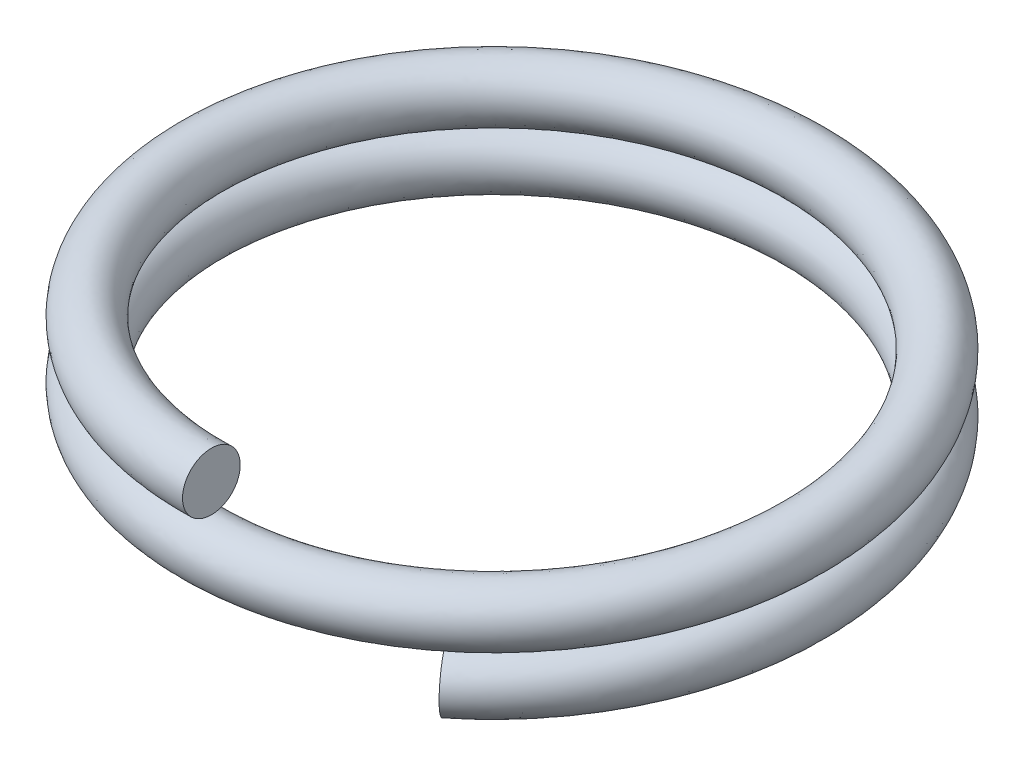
SolidWorks part; units mm, degrees
ref_plane "Front Plane" through (0, 0, 0) normal (0, 0, 1) x (1, 0, 0)
ref_plane "Top Plane" through (0, 0, 0) normal (0, 1, 0) x (1, 0, 0)
ref_plane "Right Plane" through (0, 0, 0) normal (1, 0, 0) x (0, 0, -1)
sketch "Sketch1" plane through (0, 0, 0) normal (0, 1, 0) x (1, 0, 0)
  circle A0 centre (0, 0) radius 14.5415
  dimension "D1" = 29.083
curve "Helix/Spiral3"
sketch "Sketch5" plane through (0, 0, 0) normal (1, 0, 0) x (0, 0, -1)
  circle A0 centre (-14.5415, 0) radius 1.397
  spline S0 degree 3 poles (-14.5415, 0) (-14.5415, -0.055) (-13.859, -0.1661) (-10.9287, -0.3318) (-6.495, -0.4977) (-1.1677, -0.6636) (4.3202, -0.8296) (9.2138, -0.9955) (12.8398, -1.1614) (14.6995, -1.3273) (14.5369, -1.4932) (12.3745, -1.6591) (8.5098, -1.825) (3.4743, -1.9909) (-2.0391, -2.1568) (-7.272, -2.3227) (-11.5045, -2.4887) (-14.1543, -2.6546) (-14.8569, -2.8205) (-13.5157, -2.9864) (-10.315, -3.1523) (-5.6954, -3.3182) (-0.2922, -3.4841) (5.1512, -3.65) (9.8859, -3.8159) (13.2606, -3.9818) (14.8111, -4.1478) (14.324, -4.3137) (11.8663, -4.4796) (7.7762, -4.6455) (2.6165, -4.8114) (-2.9042, -4.9774) (-8.0211, -5.1431) (-10.7076, -5.2541) (-11.7643, -5.3091) knots 0 0 0 0 0.03125 0.0625 0.09375 0.125 0.15625 0.1875 0.21875 0.25 0.28125 0.3125 0.34375 0.375 0.40625 0.4375 0.46875 0.5 0.53125 0.5625 0.59375 0.625 0.65625 0.6875 0.71875 0.75 0.78125 0.8125 0.84375 0.875 0.90625 0.9375 0.96875 1 1 1 1 construction
  dimension "D1" = 2.794
sweep "Sweep2" add profiles "Sketch5" path "Helix/Spiral3"
